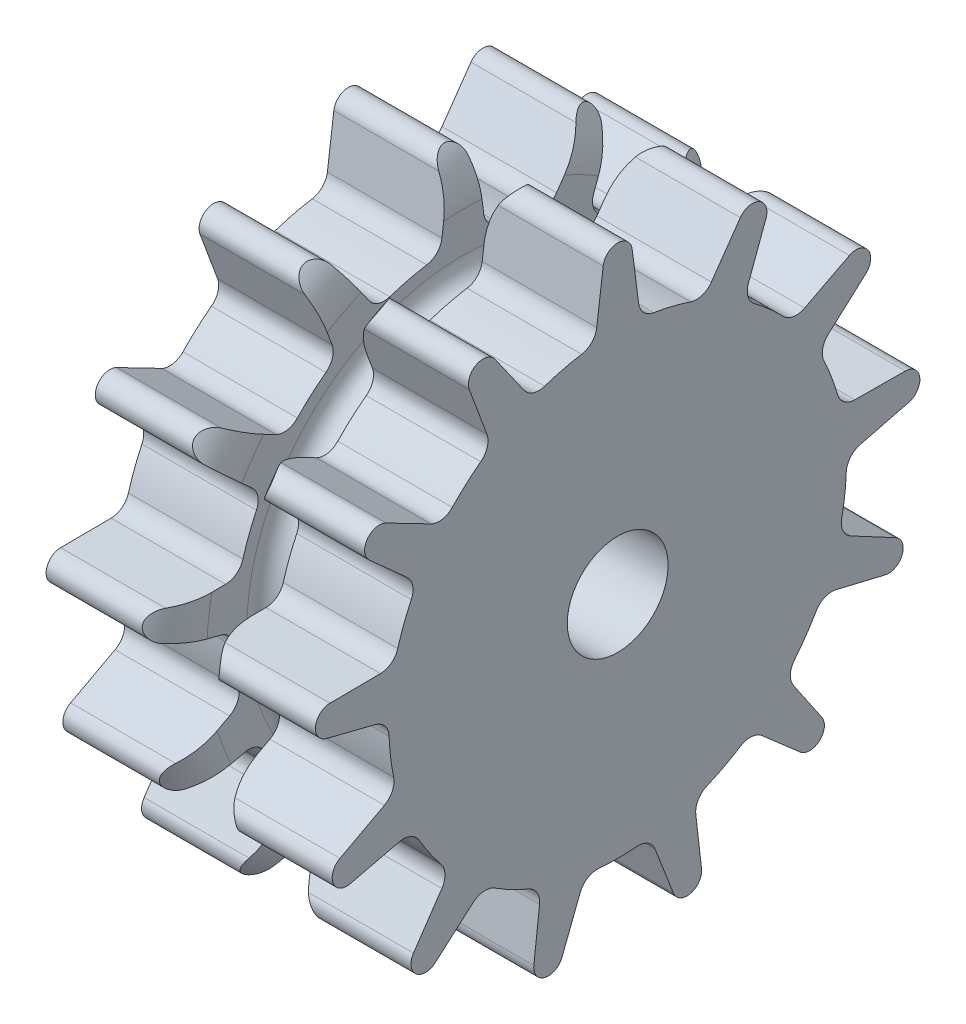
SolidWorks part; units mm, degrees
ref_plane "Plane1" through (0, 0, 0) normal (0, 0, 1) x (1, 0, 0)
ref_plane "Plane2" through (0, 0, 0) normal (0, 1, 0) x (1, 0, 0)
ref_plane "Plane3" through (0, 0, 0) normal (1, 0, 0) x (0, 0, -1)
sketch "Clipboard" plane through (0, 0, 0) normal (0, 1, 0) x (1, 0, 0)
  line L0 (0, 0) -> (4.6404, -1.0713)
  line L1 (-15, 0) -> (100, 0) construction
  line L2 (0, 0) -> (-1.5148, 1.7121)
  line L3 (0, 0) -> (-1.4236, 0.5441)
  line L4 (0, 0) -> (1.2374, 0.2857)
  line L5 (0, 0) -> (-11.8993, -4.4381)
  line L6 (0, 0) -> (-7.0326, -4.7449)
  line L7 (-1.5148, 1.7121) -> (1.2189, 14.1144)
  line L8 (-76.2, 38.1) -> (-72.771, 38.1)
  line L10 (-26.1335, 101.6321) -> (-12.5191, 101.3056)
  circle A0 centre (0, 0) radius 0.9846
  circle A1 centre (0, 0) radius 6.8072
  circle A2 centre (0, 0) radius 12.7
  dimension "Rad" = 1.9693
  dimension "MHD" = 13.6144
  dimension "Hub_dia" = 25.4
  dimension "Num_teeth" = 13
  dimension "Pitch" = 4.7625
  dimension "Grv_wid" = 1.27
  dimension "R_dim" = 2.286
  dimension "A_dim" = 1.524
  dimension "Overall_len" = 12.7
  dimension "Show_teeth" = 13
  dimension "Thickness" = 8.4836
  dimension "OAL" = 12.7001
  dimension "T_dim" = 3.429
  dimension "Gmax" = 13.6144
sketch "BasProSke" plane through (0, 0, 0) normal (0, 1, 0) x (1, 0, 0)
  line L0 (-10, 0) -> (60, 0) construction
  line L1 (0, 0) -> (0, 9.5849)
  line L2 (0, 0) -> (8.4836, 0)
  line L3 (8.4836, 0) -> (8.4836, 9.5849)
  line L4 (8.4836, 9.5849) -> (0, 9.5849)
  dimension "Diameter" = 19.1698
  dimension "Thickness" = 8.4836
revolve "Body" add sketch "BasProSke" angle 360 about L0
sketch "SidSke"
  line L0 (-14.8342, 0) -> (55.1658, 0) construction
  line L1 (0, 9.5849) -> (0, -9.5849) construction
  line L2 (11.0236, 8.0609) -> (11.0236, 10.0929)
  line L3 (11.0236, 10.0929) -> (-2.54, 10.0929)
  line L4 (7.6344, 9.8389) -> (0.8492, 9.8389)
  line L5 (-2.54, 10.0929) -> (-2.54, 8.0609)
  line L6 (8.4836, 8.0609) -> (11.0236, 8.0609)
  line L7 (0, 8.0609) -> (-2.54, 8.0609)
  line L10 (0, 9.5849) -> (0, -9.5849) construction
  arc A0 (8.4836, 8.0609) -> (7.6344, 9.8389) centre (6.1976, 8.0609) ccw
  arc A1 (0, 8.0609) -> (0.8492, 9.8389) centre (2.286, 8.0609) cw
pattern_circular "TeethCutsRound" count 13 over 360 about axis through (0, 0, 0) along (1, 0, 0)
extrude "ToothCutRound" cut sketch "TooCutRouSke" along normal through all
sketch "TooCutRouSke" plane through (0, 0, 0) normal (1, 0, 0) x (0, 0, -1)
  line L0 (0, 0) -> (-26.0771, 105.7988) construction
  line L1 (0, 0) -> (0, 105.41) construction
  line L2 (-2.9512, 7.0417) -> (-3.8625, 8.3433)
  line L3 (-0.6593, 7.6066) -> (-0.4572, 9.1826)
  line L4 (36.7334, 9.6611) -> (-33.9089, 9.6611) construction
  line L5 (-33.9089, 7.0417) -> (0, 7.0417) construction
  line L6 (0, 9.5849) -> (0, 9.8389)
  line L7 (-4.4543, 8.487) -> (-4.5724, 8.7119)
  line L8 (-2.4831, 6.798) -> (0, 6.798) construction
  circle A0 centre (0, 0) radius 9.9502 construction
  circle A1 centre (-2.3813, 9.6611) radius 1.9693 construction
  arc A2 (0, 9.5849) -> (-0.4572, 9.1826) centre (0, 9.124) ccw
  arc A3 (-2.9512, 7.0417) -> (-2.3006, 6.828) centre (-2.4831, 7.3695) ccw
  arc A4 (-1.136, 7.115) -> (-2.3006, 6.828) centre (0, 0) ccw
  arc A5 (-1.136, 7.115) -> (-0.6593, 7.6066) centre (-1.2262, 7.6793) ccw
  circle A6 centre (0, 0) radius 7.6352 construction
  arc A7 (0, 9.8389) -> (-4.5724, 8.7119) centre (0, 0) ccw
  arc A8 (-4.4543, 8.487) -> (0, 9.5849) centre (0, 0) ccw construction
  arc A9 (-3.8625, 8.3433) -> (-4.4543, 8.487) centre (-4.2401, 8.0789) ccw
  dimension "D1" = 35
  dimension "D2" = 0.4609
  dimension "D4" = 2.8631
  dimension "Pitch_radius" = 9.9502
  dimension "Rad" = 3.9386
  dimension "D3" = 0.254
  dimension "Radius" = 9.5849
  dimension "WF_fillet1" = 0.5715
  dimension "WF_fillet2" = 0.5715
  dimension "Rot" = 13.846
  dimension "WF_depth" = 2.6194
  dimension "Gap_ang" = 42.308
revolve "Sides" [suppressed] cut sketch "SidSke" angle 360 about L0
sketch "GrvSke" plane through (0, 0, 0) normal (0, 1, 0) x (1, 0, 0)
  line L0 (-14.8342, 0) -> (55.1658, 0) construction
  line L2 (4.2418, 40.64) -> (4.2418, 3.81) construction
  line L3 (4.8768, 8.0609) -> (4.8768, 6.8072)
  line L4 (3.6068, 6.8072) -> (3.6068, 8.0609)
  line L5 (2.7576, 9.8389) -> (5.726, 9.8389)
  arc A0 (4.8768, 6.8072) -> (3.6068, 6.8072) centre (4.2418, 6.8072) cw
  arc A1 (4.8768, 8.0609) -> (5.726, 9.8389) centre (7.1628, 8.0609) cw
  arc A2 (3.6068, 8.0609) -> (2.7576, 9.8389) centre (1.3208, 8.0609) ccw
  dimension "R_dim" = 2.286
  dimension "Diameter" = 19.6778
  dimension "A_dim" = 1.778
  dimension "Offset" = 4.2418
  dimension "Grv_wid" = 1.27
  dimension "Gmax" = 13.6144
revolve "Groove" cut sketch "GrvSke" angle 360 about L0
sketch "HubNeaOneSke" plane through (0, 0, 0) normal (-1, 0, 0) x (0, 0, 1)
  circle A0 centre (0, 0) radius 6.8072
  dimension "Diameter" = 13.6144
extrude "HubNearOne" [suppressed] add sketch "HubNeaOneSke" along normal blind 4.2165
sketch "HubNeaBotSke" plane through (0, 0, 0) normal (-1, 0, 0) x (0, 0, 1)
  circle A0 centre (0, 0) radius 6.8072
  dimension "Diameter" = 13.6144
extrude "HubNearBoth" [suppressed] add sketch "HubNeaBotSke" along normal blind 2.1082
ref_plane "FarPln" through (8.4836, 0, 0) normal (1, 0, 0) x (0, 0, -1)
sketch "HubFarSke" plane through (8.4836, 0, 0) normal (1, 0, 0) x (0, 0, -1)
  circle A0 centre (0, 0) radius 6.8072
  dimension "Diameter" = 13.6144
extrude "HubFar" [suppressed] add sketch "HubFarSke" along normal blind 2.1082
sketch "BorSke" plane through (0, 0, 0) normal (1, 0, 0) x (0, 0, -1)
  circle A0 centre (0, 0) radius 1.5875
  dimension "Diameter" = 3.175
extrude "Bore" cut sketch "BorSke" along normal mid plane 25.4001
sketch "KeySke" plane through (0, 0, 0) normal (1, 0, 0) x (0, 0, -1)
  line L0 (-0.127, 0) -> (-0.127, 1.8415)
  line L1 (-0.127, 1.8415) -> (0.127, 1.8415)
  line L2 (0.127, 1.8415) -> (0.127, 0)
  line L3 (0, 0) -> (0, 34) construction
  line L4 (-0.127, 0) -> (0.127, 0)
  dimension "Offset" = 1.8415
  dimension "Width" = 0.254
extrude "Keyway" [suppressed] cut sketch "KeySke" along normal mid plane 25.4001
pattern_circular "Keyway2" [suppressed] count 2 every 90 about axis through (-10, 0, 0) along (1, 0, 0)
equation "\"MHD@Clipboard\" = \"Gmax@Clipboard\""
equation "\"OAL@Clipboard\" = \"Thickness@Clipboard\""
equation "\"MHD@Clipboard\" = ((sgn( \"MHD@Clipboard\" - \"Hub_dia@Clipboard\" )-1)*( \"MHD@Clipboard\" - \"Hub_dia@Clipboard\" ))/-2+ \"Hub_dia@Clipboard\""
equation "\"OAL@Clipboard\" = ((sgn( \"OAL@Clipboard\" - \"Overall_len@Clipboard\" )+1)*( \"OAL@Clipboard\" - \"Overall_len@Clipboard\" ))/2 + \"Overall_len@Clipboard\" + 0.000002"
equation "\"Num_teeth@TeethCutsRound\" = int( \"Show_teeth@Clipboard\" ) + 1"
equation "\"Num_teeth@TeethCutsRound\" = ((sgn( \"Num_teeth@TeethCutsRound\" - \"Num_teeth@Clipboard\" )-1)*( \"Num_teeth@TeethCutsRound\" - \"Num_teeth@Clipboard\" ))/-2+ \"Num_teeth@Clipboard\""
equation "\"Num_teeth@TeethCutsRound\" = ((sgn( \"Num_teeth@TeethCutsRound\" - 2.0)+1)*( \"Num_teeth@TeethCutsRound\" - 2.0))/2 +2.0"
equation "\"Angle@TeethCutsRound\" = 360.0 / \"Num_teeth@Clipboard\""
equation "\"Radius@TooCutRouSke\" =  \"Pitch@Clipboard\" / 2.0 / tan(3.14159265 / \"Num_teeth@Clipboard\" ) - 0.016 * \"Pitch@Clipboard\""
equation "\"Pitch_radius@TooCutRouSke\" = ( \"Pitch@Clipboard\" / 2.0) / sin(3.14159265 / \"Num_teeth@Clipboard\" )"
equation "\"Rot@TooCutRouSke\" = 180 / \"Num_teeth@Clipboard\""
equation "\"Gap_ang@TooCutRouSke\" = 70.0 - 360.0 / \"Num_teeth@Clipboard\""
equation "\"Rad@TooCutRouSke\" = 0.827 * \"Pitch@Clipboard\""
equation "\"WF_depth@TooCutRouSke\" = 0.55 * \"Pitch@Clipboard\""
equation "\"WF_fillet1@TooCutRouSke\" = 0.12 * \"Pitch@Clipboard\""
equation "\"WF_fillet2@TooCutRouSke\" = 0.12 * \"Pitch@Clipboard\""
equation "\"Diameter@BasProSke\" =  (\"Pitch@Clipboard\" / 2.0 / tan(3.14159265 / \"Num_teeth@Clipboard\" ) - 0.016 * \"Pitch@Clipboard\") * 2.0"
equation "\"Thickness@BasProSke\"  = \"Thickness@Clipboard\""
equation "\"Diameter@SidSke\" = (\"Pitch@Clipboard\" / 2.0 / tan(3.14159265 / \"Num_teeth@Clipboard\" ) - 0.016 * \"Pitch@Clipboard\") * 2.0 + 0.02"
equation "\"Thickness@SidSke\" = \"Thickness@Clipboard\""
equation "\"A_dim@SidSke\" = \"A_dim@Clipboard\" + 0.01"
equation "\"R_dim@SidSke\" = \"R_dim@Clipboard\""
equation "\"Diameter@GrvSke\" = (\"Pitch@Clipboard\" / 2.0 / tan(3.14159265 / \"Num_teeth@Clipboard\" ) - 0.016 * \"Pitch@Clipboard\") * 2.0 + 0.02"
equation "\"Offset@GrvSke\" = \"Thickness@Clipboard\" / 2.0 "
equation "\"A_dim@GrvSke\" = \"A_dim@Clipboard\" + 0.01"
equation "\"R_dim@GrvSke\" = \"R_dim@Clipboard\""
equation "\"Grv_wid@GrvSke\" = \"Grv_wid@Clipboard\""
equation "\"Gmax@GrvSke\" = \"Gmax@Clipboard\""
equation "\"Diameter@HubNeaOneSke\" = \"MHD@Clipboard\""
equation "\"Length@HubNearOne\" = \"OAL@Clipboard\" - \"Thickness@BasProSke\""
equation "\"Diameter@HubNeaBotSke\" = \"MHD@Clipboard\""
equation "\"Length@HubNearBoth\" = ( \"OAL@Clipboard\" - \"Thickness@BasProSke\" ) / 2.0"
equation "\"Thickness@FarPln\" = \"Thickness@BasProSke\""
equation "\"Diameter@HubFarSke\" = \"MHD@Clipboard\""
equation "\"Length@HubFar\" = ( \"OAL@Clipboard\" - \"Thickness@BasProSke\" ) / 2.0"
equation "\"D1@Bore\" = \"OAL@Clipboard\" * 2.0"
equation "\"D1@Keyway\" = \"OAL@Clipboard\" * 2.0"
equation "\"Offset@KeySke\" = \"T_dim@Clipboard\" - \"Diameter@BorSke\" / 2.0"
